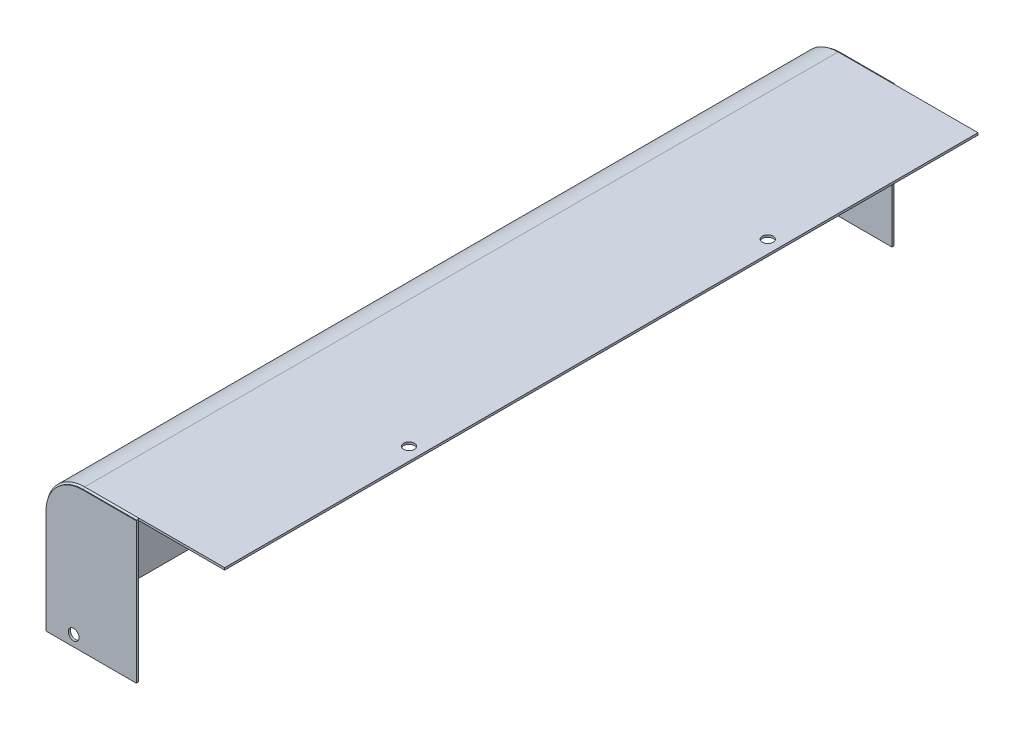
SolidWorks part; units mm, degrees
other "Objet de détail2"
other "Objet de détail3"
ref_plane "Face" through (0, 0, 0) normal (0, 0, 1) x (1, 0, 0)
ref_plane "Dessus" through (0, 0, 0) normal (0, 1, 0) x (1, 0, 0)
ref_plane "Droite" through (0, 0, 0) normal (1, 0, 0) x (0, 0, -1)
sketch "Esquisse1" plane through (0, 0, 0) normal (0, 0, 1) x (1, 0, 0)
  line L0 (-32.3473, -130.3539) -> (-32.3473, 14.6461)
  line L1 (20.6527, 67.6461) -> (215.6527, 67.6461)
  line L2 (-29.3473, -130.3539) -> (-29.3473, 14.6461)
  line L3 (20.6527, 64.6461) -> (215.6527, 64.6461)
  line L4 (215.6527, 67.6461) -> (215.6527, 64.6461)
  line L5 (-32.3473, -130.3539) -> (-29.3473, -130.3539)
  arc A0 (-29.3473, 14.6461) -> (20.6527, 64.6461) centre (20.6527, 14.6461) cw
  arc A1 (-32.3473, 14.6461) -> (20.6527, 67.6461) centre (20.6527, 14.6461) cw
  point P5 (-29.3473, 64.6461)
  dimension "D3" = 50
  dimension "D1" = 245
  dimension "D2" = 195
  dimension "D4" = 3
extrude "Extrusion1" add sketch "Esquisse1" along normal blind 1050
sketch "Esquisse2" plane through (0, 0, 1050) normal (0, 0, 1) x (1, 0, 0)
  line L0 (-30.3473, -130.3539) -> (95.6527, -130.3539)
  line L2 (95.6527, -130.3539) -> (95.6527, 65.6461)
  line L4 (95.6527, 65.6461) -> (20.6527, 65.6461)
  line L5 (-30.3473, 14.6461) -> (-30.3473, -130.3539)
  line L6 (-32.3473, 14.6461) -> (-32.3473, -130.3539) construction
  line L7 (215.6527, 67.6461) -> (20.6527, 67.6461) construction
  arc A0 (-30.3473, 14.6461) -> (20.6527, 65.6461) centre (20.6527, 14.6461) cw
  dimension "D4" = 51
  dimension "D1" = 126
  dimension "D2" = 2
  dimension "D3" = 2
extrude "Extrusion2" add sketch "Esquisse2" along normal blind 3 separate body
sketch "Esquisse3" plane through (0, 0, 0) normal (0, 0, -1) x (-1, 0, 0)
  line L0 (-95.6527, -130.3539) -> (30.3473, -130.3539)
  line L1 (30.3473, -130.3539) -> (-95.6527, -130.3539) construction
  line L2 (32.3473, 14.6461) -> (32.3473, -130.3539) construction
  line L3 (-95.6527, -130.3539) -> (-95.6527, 65.6461)
  line L4 (-95.6527, -130.3539) -> (-95.6527, 65.6461) construction
  line L5 (-215.6527, 67.6461) -> (-20.6527, 67.6461) construction
  line L6 (-95.6527, 65.6461) -> (-20.6527, 65.6461)
  line L7 (30.3473, -130.3539) -> (30.3473, 14.6461)
  arc A0 (-20.6527, 65.6461) -> (30.3473, 14.6461) centre (-20.6527, 14.6461) cw
  dimension "D4" = 51
  dimension "D1" = 126
  dimension "D2" = 128
  dimension "D3" = 2
extrude "Extrusion3" add sketch "Esquisse3" along normal blind 3 separate body
other "Cordon de soudure d'angle2" parameters "D10"=6, "D11"=2, "D12"=0, "D13"=3, "D14"=0
other "Cordon de soudure d'angle3" parameters "D10"=6, "D11"=2, "D12"=0, "D13"=3, "D14"=0
sketch "Esquisse5" plane through (0, 67.6461, 0) normal (0, 1, 0) x (-1, 0, 0)
  line L0 (-215.6527, 0) -> (-20.6527, 0) construction
  line L1 (-215.6527, 1050) -> (-215.6527, 0) construction
  circle A0 centre (-197.6527, 275) radius 7.5
  circle A1 centre (-197.6527, 775) radius 7.5
  dimension "D1" = 15
  dimension "D2" = 15
  dimension "D4" = 275
  dimension "D5" = 18
  dimension "D3" = 500
extrude "Enlèv. mat.-Extru.1" cut sketch "Esquisse5" against normal blind 3
sketch "Esquisse6" plane through (0, 0, -3) normal (0, 0, -1) x (-1, 0, 0)
  line L0 (-95.6527, 65.6461) -> (-95.6527, -130.3539) construction
  line L1 (-95.6527, -130.3539) -> (30.3473, -130.3539) construction
  circle A0 centre (-8.1527, -115.3539) radius 7.5
  dimension "D1" = 15
  dimension "D2" = 87.5
  dimension "D3" = 15
extrude "Enlèv. mat.-Extru.2" cut sketch "Esquisse6" against normal through all
